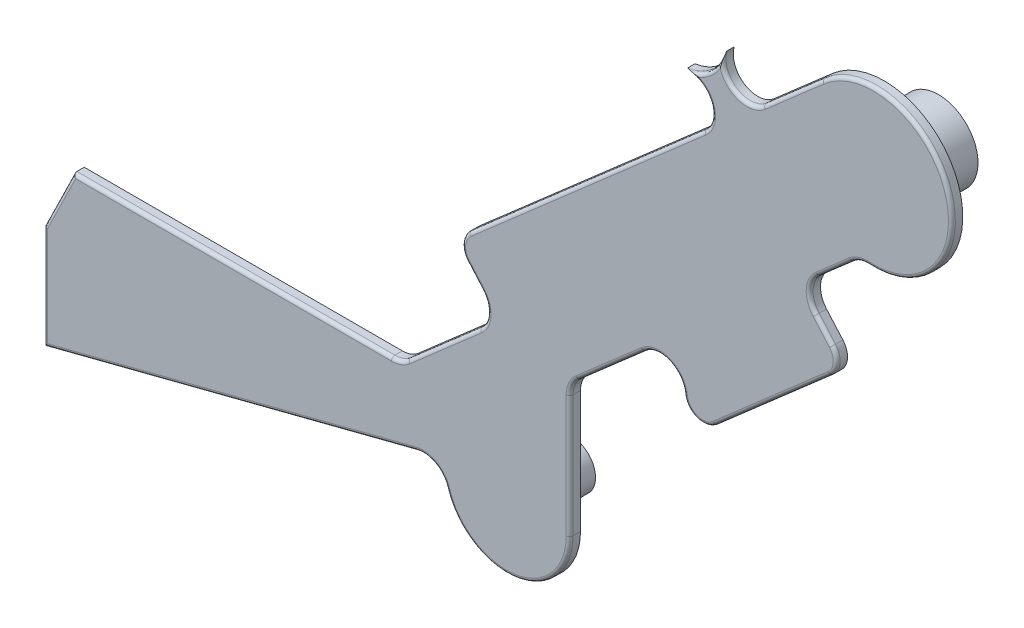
SolidWorks part; units mm, degrees
ref_plane "Front" through (0, 0, 0) normal (0, 0, 1) x (1, 0, 0)
ref_plane "Top" through (0, 0, 0) normal (0, 1, 0) x (1, 0, 0)
ref_plane "Right" through (0, 0, 0) normal (1, 0, 0) x (0, 0, -1)
mirrored part "Cover Plate_Mirrored"
other "<Cover Plate>-<Fillet1>"
